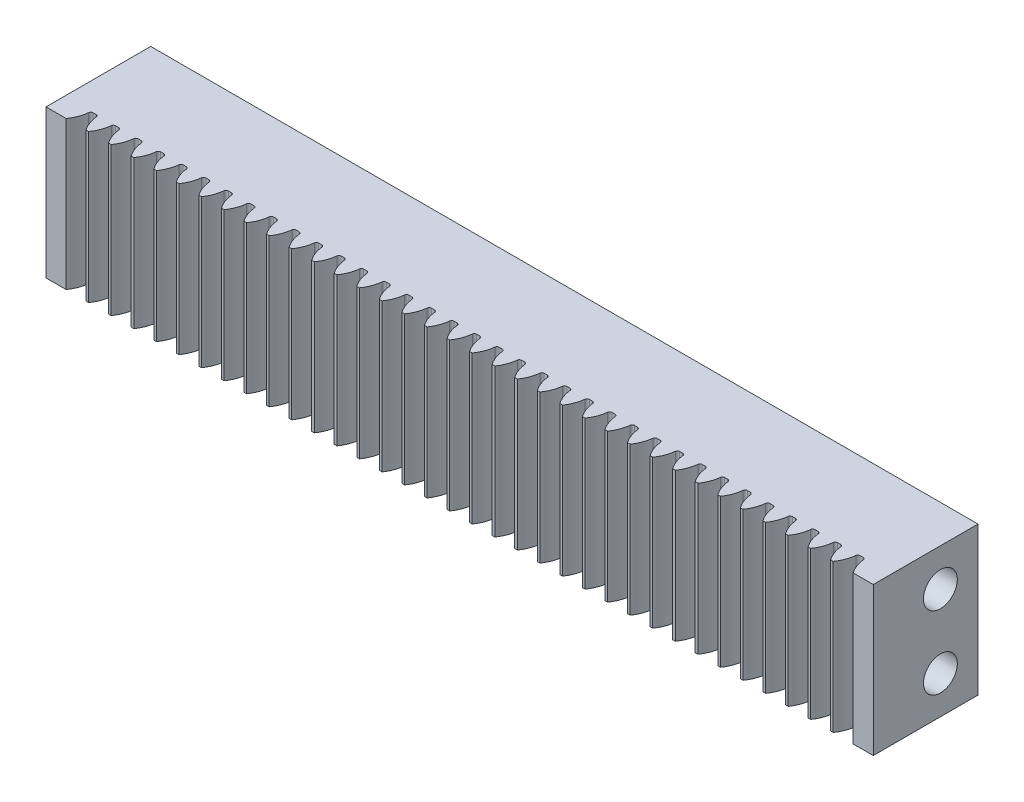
SolidWorks part; units mm, degrees
ref_plane "Ebene vorne" through (0, 0, 0) normal (0, 0, 1) x (1, 0, 0)
ref_plane "Ebene oben" through (0, 0, 0) normal (0, 1, 0) x (1, 0, 0)
ref_plane "Ebene rechts" through (0, 0, 0) normal (1, 0, 0) x (0, 0, -1)
sketch "Skizze8" plane through (0, 0, 0) normal (0, 1, 0) x (1, 0, 0)
  line L1 (0, 0) -> (110, 0)
  line L2 (0, 0) -> (0, 13.925)
  line L3 (0, 13.925) -> (110, 13.925)
  line L4 (110, 0) -> (110, 13.925)
  dimension "D1" = 13.925
  dimension "D2" = 110
extrude "Aufsatz-Linear austragen3" add sketch "Skizze8" along normal blind 19.7
sketch "Skizze9" plane through (0, 0, 0) normal (0, -1, 0) x (1, 0, 0)
  line L0 (10, -21.7) -> (10, 0.153) construction
  line L1 (9.7979, -2.45) -> (10.2021, -2.45)
  line L2 (0, -13.925) -> (0, 0) construction
  line L3 (0, 0) -> (110, 0) construction
  arc A0 (10.5005, -2.1811) -> (12.0608, 0.8022) centre (15.0359, -2.6535) cw
  arc A1 (9.4995, -2.1811) -> (7.9392, 0.8022) centre (4.9641, -2.6535) ccw
  arc A2 (7.9392, 0.8022) -> (12.0608, 0.8022) centre (10, -17.0794) cw
  arc A3 (10.2021, -2.45) -> (10.5005, -2.1811) centre (10.2021, -2.15) ccw
  arc A4 (9.4995, -2.1811) -> (9.7979, -2.45) centre (9.7979, -2.15) ccw
  point P9 (10, -2.45)
  dimension "D1" = 4.56
  dimension "D2" = 18
  dimension "D3" = 0.3
  dimension "D4" = 19.25
  dimension "D5" = 10
  dimension "D6" = 21.7
extrude "Schnitt-Linear austragen1" cut sketch "Skizze9" against normal blind 19.7
pattern_linear "Lineares Muster1" count 33 spacing 3 along (1, 0, 0) of "Schnitt-Linear austragen1"
pattern_linear "Lineares Muster2" count 3 spacing 3 along (-1, 0, 0) of "Schnitt-Linear austragen1"
sketch "Skizze10" plane through (110, 0, 0) normal (1, 0, 0) x (0, 0, -1)
  line L0 (13.925, 19.7) -> (13.925, 0) construction
  line L1 (0, 19.7) -> (13.925, 19.7) construction
  line L2 (0, 0) -> (13.925, 0) construction
  circle A0 centre (8.925, 14.7) radius 2.25
  circle A1 centre (8.925, 5) radius 2.25
  dimension "D1" = 4.5
  dimension "D2" = 4.5
  dimension "D3" = 5
  dimension "D4" = 5
  dimension "D5" = 5
  dimension "D6" = 5
extrude "Schnitt-Linear austragen2" cut sketch "Skizze10" against normal blind 12
